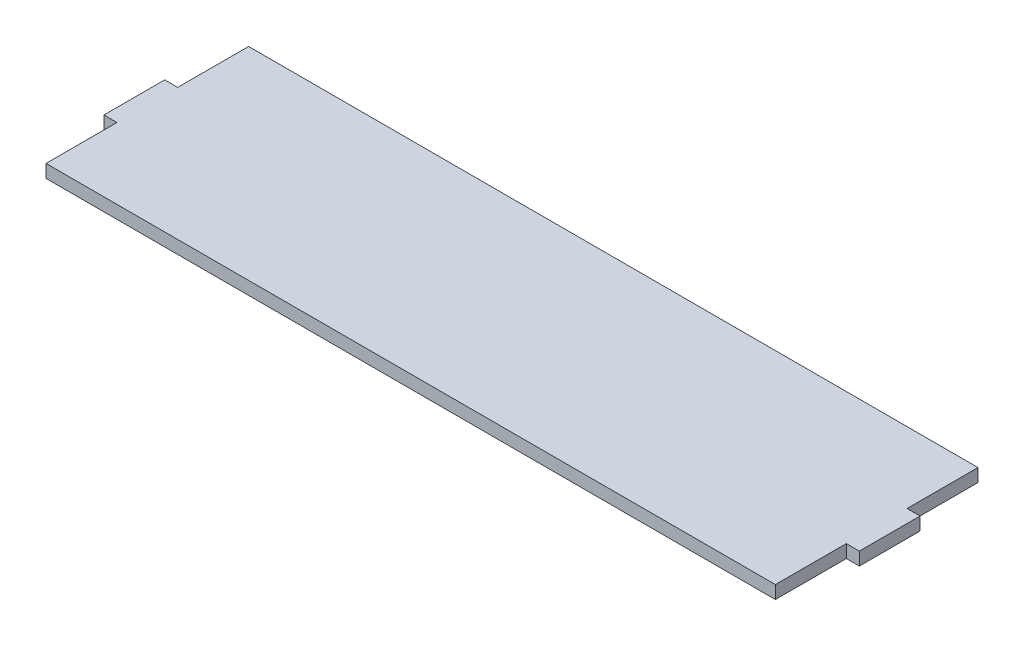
SolidWorks part; units mm, degrees
ref_plane "Front Plane" through (0, 0, 0) normal (0, 0, 1) x (1, 0, 0)
ref_plane "Top Plane" through (0, 0, 0) normal (0, 1, 0) x (1, 0, 0)
ref_plane "Right Plane" through (0, 0, 0) normal (1, 0, 0) x (0, 0, -1)
sketch "Sketch1" plane through (0, 0, 0) normal (0, 1, 0) x (1, 0, 0)
  line L0 (397.828, 234.7234) -> (397.828, -32.3187) construction
  line L1 (-59.372, 234.7234) -> (855.028, 234.7234)
  line L2 (-59.372, 145.8234) -> (-59.372, 234.7234)
  line L3 (-59.372, -19.2766) -> (855.028, -19.2766)
  line L4 (855.028, 234.7234) -> (855.028, 145.8234)
  line L5 (871.328, 69.6234) -> (855.028, 69.6234)
  line L6 (-59.372, 145.8234) -> (-75.672, 145.8234)
  line L7 (-75.672, 145.8234) -> (-75.672, 69.6234)
  line L8 (-75.672, 69.6234) -> (-59.372, 69.6234)
  line L9 (871.328, 145.8234) -> (871.328, 69.6234)
  line L10 (855.028, 145.8234) -> (871.328, 145.8234)
  line L11 (-59.372, 69.6234) -> (-59.372, -19.2766)
  line L12 (855.028, 69.6234) -> (855.028, -19.2766)
  point P14 (-75.672, 107.7234)
extrude "Boss-Extrude1" add sketch "Sketch1" along normal blind 16.3
